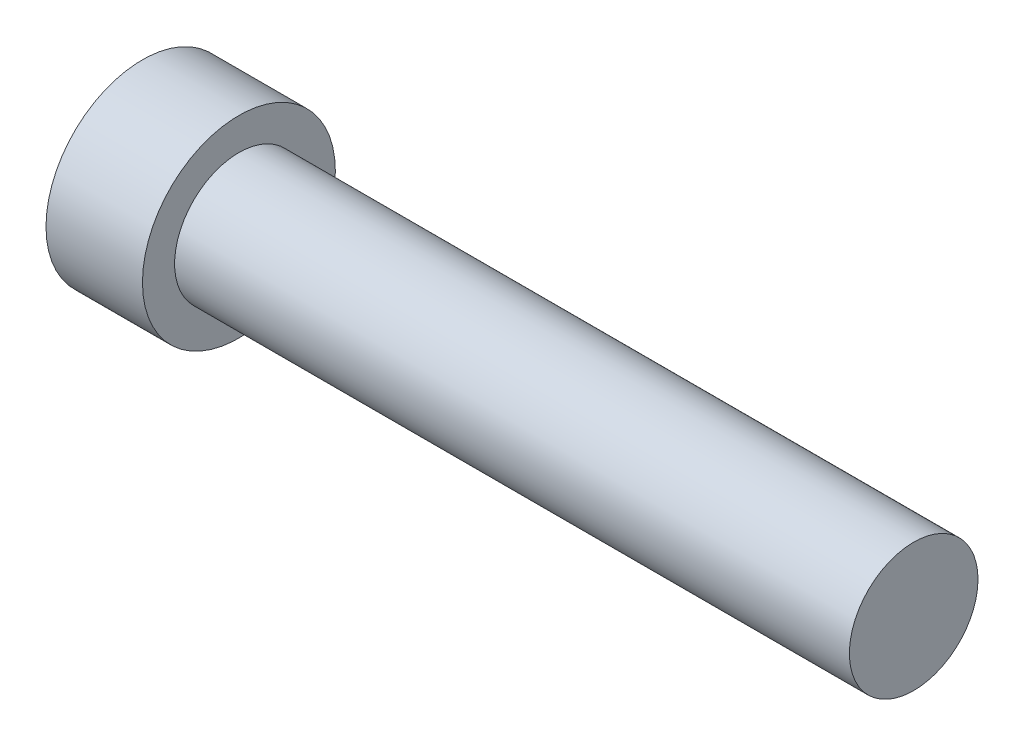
SolidWorks part; units mm, degrees
ref_plane "Front Plane" through (0, 0, 0) normal (1, 0, 0) x (0, 1, 0)
ref_plane "Top Plane" through (0, 0, 0) normal (0, 0, 1) x (0, 1, 0)
ref_plane "Right Plane" through (0, 0, 0) normal (0, 1, 0) x (-1, 0, 0)
sketch "Sketch1" plane through (0, 0, 0) normal (1, 0, 0) x (0, 1, 0)
  circle A0 centre (0, 0) radius 15
  dimension "D1" = 30
extrude "Boss-Extrude1" add sketch "Sketch1" along normal blind 15
sketch "Sketch2" plane through (15, 0, 0) normal (1, 0, 0) x (0, 1, 0)
  circle A0 centre (0, 0) radius 10
  dimension "D1" = 20
extrude "Boss-Extrude2" add sketch "Sketch2" along normal blind 104.94
